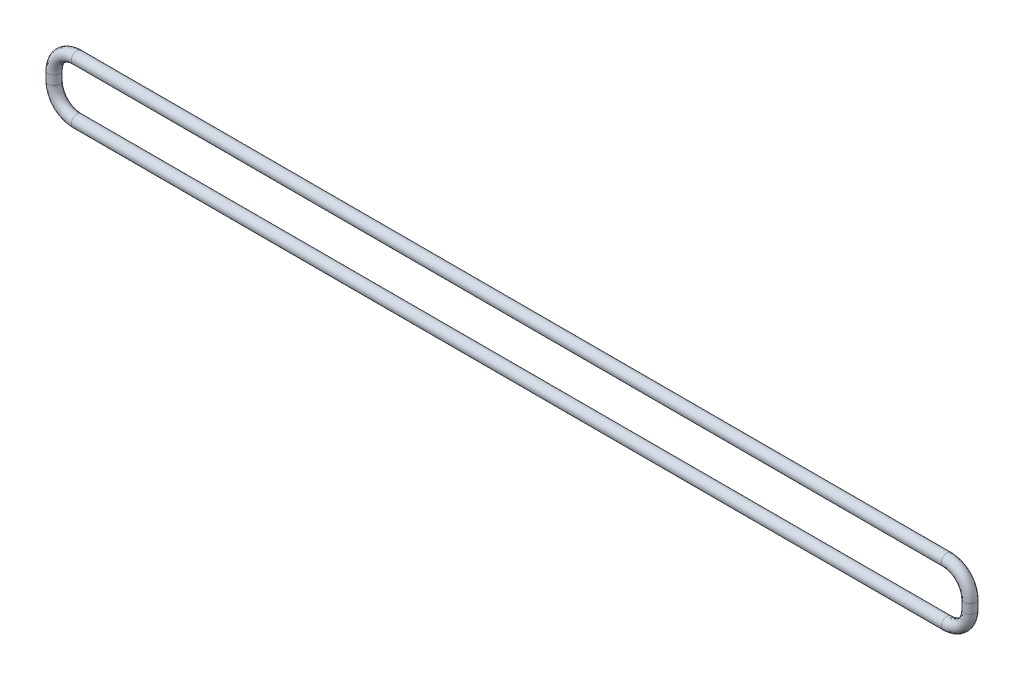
SolidWorks part; units mm, degrees
ref_plane "Front Plane" through (0, 0, 0) normal (0, 0, 1) x (1, 0, 0)
ref_plane "Top Plane" through (0, 0, 0) normal (0, 1, 0) x (1, 0, 0)
ref_plane "Right Plane" through (0, 0, 0) normal (1, 0, 0) x (0, 0, -1)
sketch "Sketch1" plane through (0, 0, 0) normal (0, 0, 1) x (1, 0, 0)
  line L1 (0, 0) -> (96.52, 0)
  line L2 (-2.54, 2.54) -> (-2.54, 3.556)
  line L3 (0, 6.096) -> (96.52, 6.096)
  line L4 (99.06, 2.54) -> (99.06, 3.556)
  arc A0 (96.52, 0) -> (99.06, 2.54) centre (96.52, 2.54) ccw
  arc A1 (96.52, 6.096) -> (99.06, 3.556) centre (96.52, 3.556) cw
  arc A2 (-2.54, 3.556) -> (0, 6.096) centre (0, 3.556) cw
  arc A3 (0, 0) -> (-2.54, 2.54) centre (0, 2.54) cw
  point P9 (99.06, 6.096)
  point P12 (-2.54, 6.096)
  point P15 (-2.54, 0)
  dimension "D3" = 2.54
  dimension "D1" = 6.096
  dimension "D2" = 101.6
sketch "Sketch2" plane through (0, 0, 0) normal (1, 0, 0) x (0, 0, -1)
  circle A0 centre (0, 0) radius 0.635
  dimension "D1" = 1.27
sweep "Sweep1" add profiles "Sketch2" path "Sketch1"
